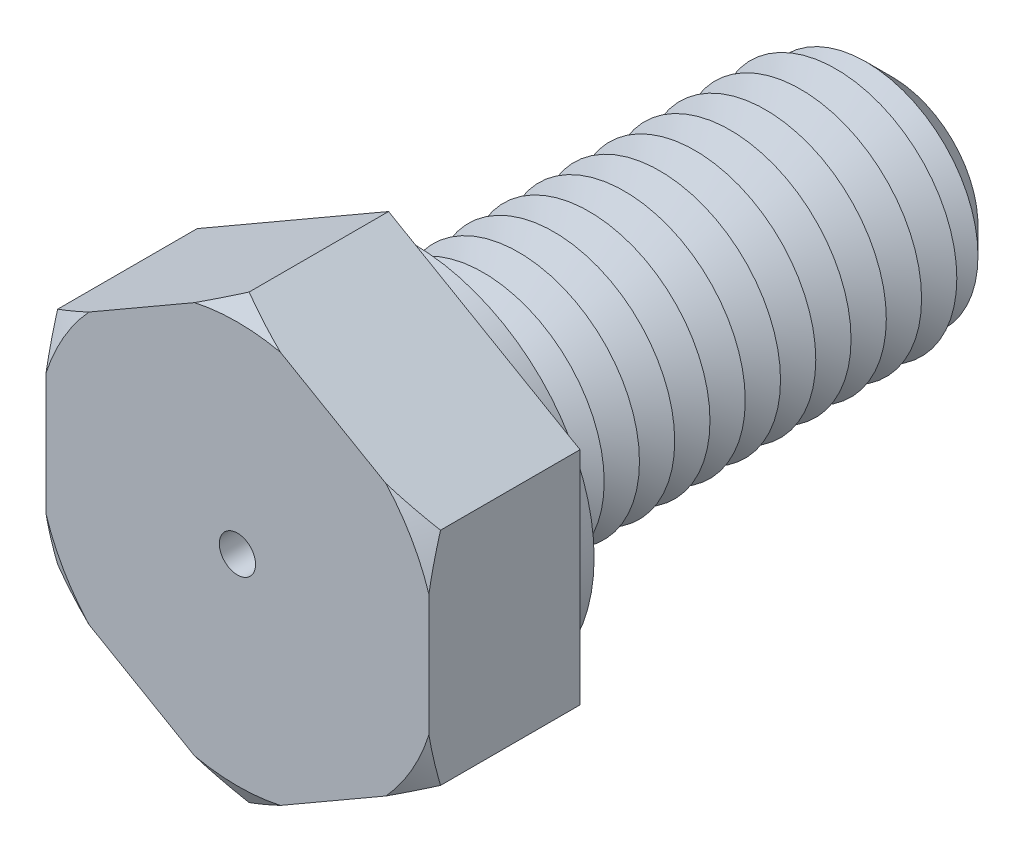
SolidWorks part; units mm, degrees
ref_plane "Front Plane" through (0, 0, 0) normal (0, 0, 1) x (1, 0, 0)
ref_plane "Top Plane" through (0, 0, 0) normal (0, 1, 0) x (1, 0, 0)
ref_plane "Right Plane" through (0, 0, 0) normal (1, 0, 0) x (0, 0, -1)
sketch "Sketch2" plane through (0, 0, 0) normal (0, 0, 1) x (1, 0, 0)
  line L1 (0, 10.9697) -> (-9.5, 5.4848)
  line L2 (-9.5, 5.4848) -> (-9.5, -5.4848)
  line L3 (-9.5, -5.4848) -> (0, -10.9697)
  line L4 (0, -10.9697) -> (9.5, -5.4848)
  line L5 (9.5, -5.4848) -> (9.5, 5.4848)
  line L6 (9.5, 5.4848) -> (0, 10.9697)
  circle A0 centre (0, 0) radius 9.5 construction
  dimension "D1" = 19
extrude "Boss-Extrude1" add sketch "Sketch2" along normal blind 7.5
sketch "Sketch3" plane through (0, 0, 0) normal (0, 0, -1) x (-1, 0, 0)
  circle A0 centre (0, 0) radius 6
  dimension "D1" = 12
extrude "Boss-Extrude2" add sketch "Sketch3" along normal blind 25
sketch "Sketch4" plane through (0, 0, 0) normal (0, 0, -1) x (-1, 0, 0)
  circle A0 centre (0, 0) radius 9
  dimension "D1" = 18
extrude "Boss-Extrude3" add sketch "Sketch4" along normal blind 1.2
sketch "Sketch5" plane through (0, 0, 0) normal (1, 0, 0) x (0, 0, -1)
  line L0 (-3.2117, 0) -> (6.3192, 0) construction
chamfer "Chamfer1" distance 1.75 angle 45 1 edges at (-6, 0, -25)
sketch "Sketch6" plane through (0, 0, 0) normal (1, 0, 0) x (0, 0, -1)
  line L0 (1.2, 6) -> (2.075, 4.4845)
  line L1 (2.075, 4.4845) -> (2.95, 6)
  line L2 (23.25, 6) -> (1.2, 6) construction
  line L3 (2.95, 6) -> (1.2, 6)
  dimension "D1" = 1.75
revolve "Cut-Revolve1" cut sketch "Sketch6" angle 360 about L0
pattern_linear "LPattern1" count 13 spacing 1.75 along (0, 0, -1) of "Cut-Revolve1"
sketch "Sketch7" plane through (0, 0, 0) normal (1, 0, 0) x (0, 0, -1)
  line L0 (-7.5, 10.9697) -> (-7.5, 9.9697)
  line L1 (-7.5, 5.4848) -> (-7.5, 10.9697) construction
  line L2 (-7.5, 9.9697) -> (-6.9226, 10.9697)
  line L3 (-7.5, 10.9697) -> (0, 10.9697) construction
  line L4 (-6.9226, 10.9697) -> (-7.5, 10.9697)
  dimension "D1" = 1
  dimension "D2" = 30
revolve "Cut-Revolve2" cut sketch "Sketch7" angle 360 about L0
sketch "Sketch8" plane through (0, 0, 7.5) normal (0, 0, 1) x (1, 0, 0)
  circle A0 centre (0, 0) radius 0.9
  dimension "D1" = 1.8
extrude "Cut-Extrude1" cut sketch "Sketch8" against normal up to surface (32.5 mm away)
